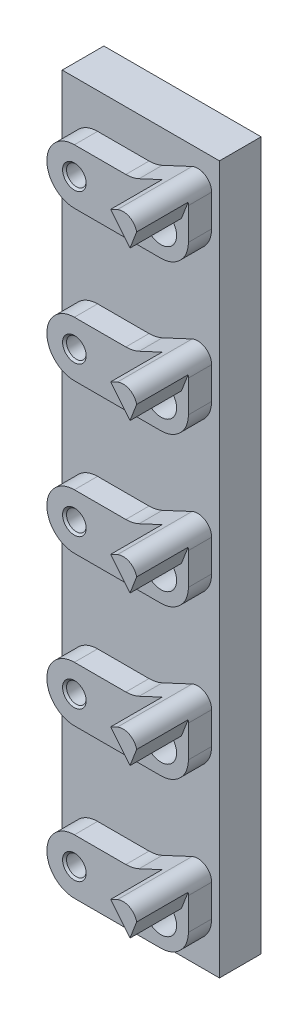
SolidWorks part; units mm, degrees
ref_plane "Face" through (0, 0, 0) normal (0, 0, 1) x (1, 0, 0)
ref_plane "Dessus" through (0, 0, 0) normal (0, 1, 0) x (1, 0, 0)
ref_plane "Droite" through (0, 0, 0) normal (1, 0, 0) x (0, 0, -1)
sketch "Esquisse1" plane through (0, 0, 0) normal (0, 0, 1) x (1, 0, 0)
  line L0 (3.5, 0) -> (3.5, 4.05)
  line L1 (0, -3.5) -> (-11, -3.5)
  line L2 (-11, 17.3873) -> (-11, -12.0489) construction
  line L3 (-21.0651, 0) -> (-4.2837, 0) construction
  line L4 (-11, 3.5) -> (-4.4571, 3.5)
  line L5 (-2.7666, 3.8748) -> (1.0104, 5.636)
  arc A0 (0, -3.5) -> (3.5, 0) centre (0, 0) ccw
  arc A1 (-11, 3.5) -> (-11, -3.5) centre (-11, 0) ccw
  arc A2 (1.0104, 5.636) -> (3.5, 4.05) centre (1.75, 4.05) cw
  arc A3 (-4.4571, 3.5) -> (-2.7666, 3.8748) centre (-4.4571, 7.5) ccw
  dimension "D1" = 7
  dimension "D5" = 1.75
  dimension "D6" = 4
  dimension "D2" = 11
  dimension "D3" = 3.5
  dimension "D4" = 155
  dimension "D7" = 4.05
  dimension "D8" = 7
extrude "Extrusion1" add sketch "Esquisse1" along normal blind 2.95
sketch "Esquisse2" plane through (0, 0, 2.95) normal (0, 0, 1) x (1, 0, 0)
  line L0 (0.1585, 5.2388) -> (2.6192, 2.2)
  line L1 (0, 0) -> (-7.3979, 0) construction
  line L2 (2.6192, 2.2) -> (3.4643, 4.4016)
  line L3 (1.0104, 5.636) -> (-2.7666, 3.8748) construction
  line L4 (1.0104, 5.636) -> (0.1585, 5.2388)
  arc A0 (3.5, 4.05) -> (1.0104, 5.636) centre (1.75, 4.05) ccw construction
  arc A1 (3.4643, 4.4016) -> (1.0104, 5.636) centre (1.75, 4.05) ccw
  dimension "D1" = 51
  dimension "D2" = 3.42
  dimension "D3" = 60
  dimension "D4" = 2.2
extrude "Extrusion2" add sketch "Esquisse2" along normal blind 6.55
sketch "Esquisse3" plane through (0, 0, 2.95) normal (0, 0, 1) x (1, 0, 0)
  circle A0 centre (0, 0) radius 2
  dimension "D1" = 4
extrude "Enlèv. mat.-Extru.1" cut sketch "Esquisse3" against normal blind 6.55
hole_wizard "Trou taraudé M3x0.54" positions "Esquisse3D6" profile "Esquisse9" tap size "M3x0.5" standard "ISO"
sketch3d "Esquisse3D6"
  arc A0 (-11, 3.5, 2.95) -> (-11, -3.5, 2.95) centre (-11, 0, 2.95) ccw construction
  point P0 (-11, 0, 2.95)
  point P10 (-11, 0, 6.45)
sketch "Esquisse9" plane through (-11, 0, 2.95) normal (1, 0, 0) x (0, -1, 0)
  line L0 (0, 0) -> (0, 2.95)
  line L1 (0, 2.95) -> (1.5, 2.95)
  line L2 (1.25, 2.7) -> (1.25, 0.25)
  line L3 (1.25, 0.25) -> (1.5, 0)
  line L5 (1.5, 0) -> (0, 0)
  line L6 (-1.25, 0.25) -> (-1.5, 0) construction
  line L7 (1.5, 2.95) -> (1.25, 2.7)
  line L8 (-1.5, 2.95) -> (-1.25, 2.7) construction
  line L11 (0, -6.35) -> (0, 107.95) construction
  dimension "Diamètre du trou pour taraudage jusqu'au prochain" = 2.5
  dimension "Profondeur du trou pour taraudage jusqu'au prochain" = 2.95
  dimension "Diamètre du fraisage entrant" = 3
  dimension "Angle du fraisage entrant" = 90
  dimension "Diamètre du fraisage débouchant" = 3
  dimension "Angle du fraisage débouchant" = 90
move or copy body "Corps-Déplacer/Copier1" bodies to move or copy 107
sketch "Esquisse11" plane through (0, 0, 0) normal (0, 0, -1) x (-1, 0, 0)
  line L1 (-4.5, 84) -> (15.5, 84)
  line L2 (-4.5, 84) -> (-4.5, -6)
  line L3 (-4.5, -6) -> (15.5, -6)
  line L4 (15.5, 84) -> (15.5, -6)
  dimension "D1" = 20
  dimension "D2" = 90
  dimension "D3" = 4.5
  dimension "D4" = 6
extrude "Extrusion5" add sketch "Esquisse11" along normal blind 5.3
